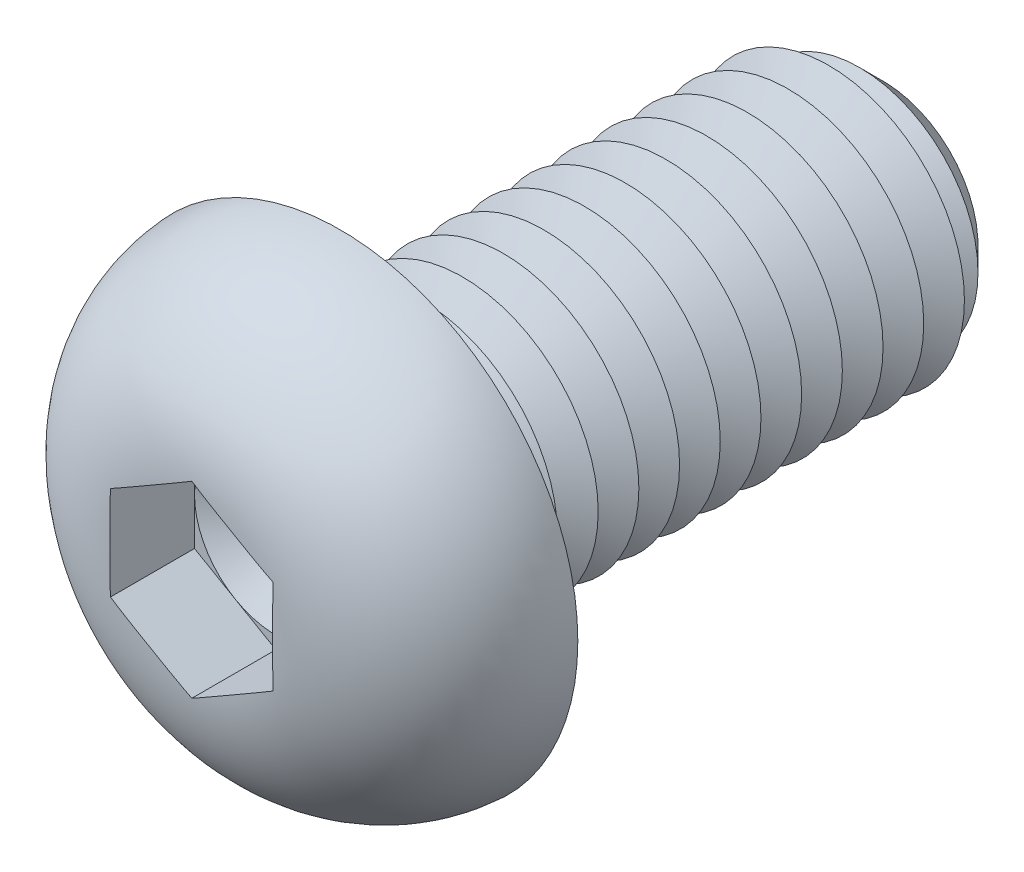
SolidWorks part; units mm, degrees
ref_plane "Front Plane" through (0, 0, 0) normal (0, 0, 1) x (1, 0, 0)
ref_plane "Top Plane" through (0, 0, 0) normal (0, 1, 0) x (1, 0, 0)
ref_plane "Right Plane" through (0, 0, 0) normal (1, 0, 0) x (0, 0, -1)
sketch "Sketch1" plane through (0, 0, 0) normal (1, 0, 0) x (0, 0, -1)
  line L0 (-47.9342, 0) -> (60.3146, 0) construction
sketch "Sketch2" plane through (0, 0, 0) normal (1, 0, 0) x (0, 0, -1)
  line L0 (0, 0) -> (-5.5, 0)
  line L1 (-47.9342, 0) -> (60.3146, 0) construction
  line L2 (-5.5, 0) -> (-5.5, 2.9578)
  line L3 (0, 8.75) -> (0, 0)
  arc A0 (-5.5, 2.9578) -> (0, 8.75) centre (0.3, 2.9578) cw
  dimension "D1" = 5.8
  dimension "D2" = 5.5
  dimension "D3" = 8.75
revolve "Revolve1" add sketch "Sketch2" angle 360 about L0
sketch "Sketch3" plane through (0, 0, 5.5) normal (0, 0, 1) x (1, 0, 0)
  line L1 (0, 3.4641) -> (-3, 1.7321)
  line L2 (-3, 1.7321) -> (-3, -1.7321)
  line L3 (-3, -1.7321) -> (0, -3.4641)
  line L4 (0, -3.4641) -> (3, -1.7321)
  line L5 (3, -1.7321) -> (3, 1.7321)
  line L6 (3, 1.7321) -> (0, 3.4641)
  circle A0 centre (0, 0) radius 3 construction
  dimension "D1" = 6
extrude "Cut-Extrude1" cut sketch "Sketch3" against normal blind 3.12
sketch "Sketch4" plane through (0, 0, 0) normal (0, 0, -1) x (-1, 0, 0)
  circle A0 centre (0, 0) radius 5
  dimension "D1" = 10
extrude "Boss-Extrude1" add sketch "Sketch4" along normal blind 20
chamfer "Chamfer1" distance 1.5 angle 45 1 edges at (-5, 0, -20)
sketch "Sketch5" plane through (0, 0, 0) normal (1, 0, 0) x (0, 0, -1)
  line L0 (1.5, 5) -> (3, 5)
  line L1 (18.5, 5) -> (0, 5) construction
  line L2 (3, 5) -> (2.25, 3.701)
  line L3 (2.25, 3.701) -> (1.5, 5)
  line L4 (0, -8.75) -> (0, 8.75) construction
  line L5 (18.5, 5) -> (0, 5) construction
  dimension "D1" = 1.5
  dimension "D2" = 1.5
revolve "Cut-Revolve1" cut sketch "Sketch5" angle 360 about L0
pattern_linear "LPattern1" count 12 spacing 1.5 along (0, 0, -1) of "Cut-Revolve1"
fillet "Fillet2" radius 0.6 1 edges at (5, 0, 0)
sketch "Sketch6" plane through (0, 0, 2.38) normal (0, 0, 1) x (1, 0, 0)
  line L0 (0, -3.4641) -> (3, -1.7321) construction
  circle A0 centre (0, 0) radius 3
extrude "Cut-Extrude2" cut sketch "Sketch6" against normal through all draft 60
